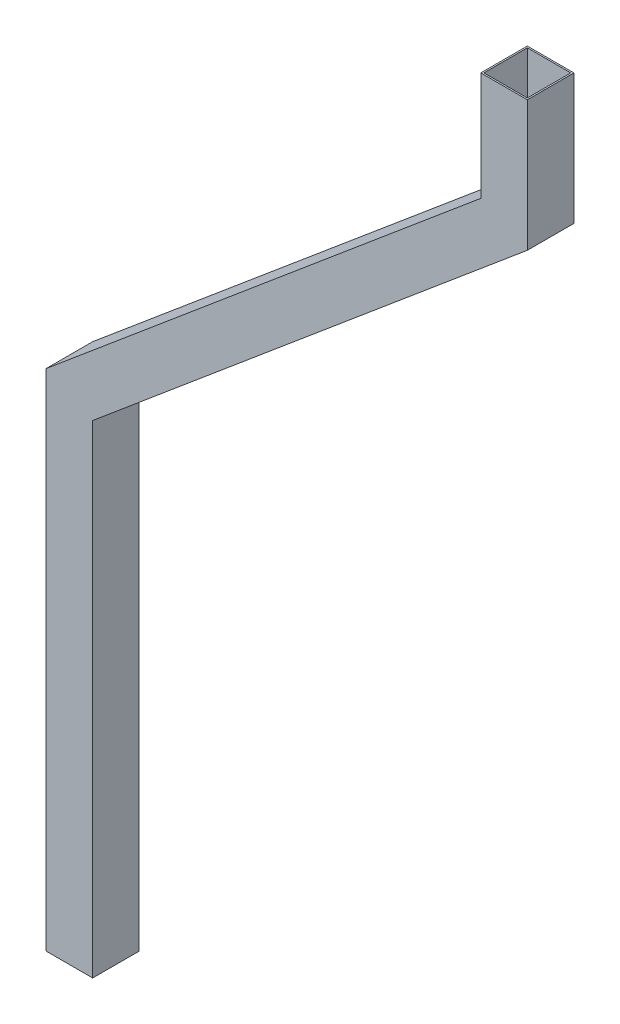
SolidWorks part; units mm, degrees
ref_plane "Piano frontale" through (0, 0, 0) normal (0, 0, 1) x (1, 0, 0)
ref_plane "Piano superiore" through (0, 0, 0) normal (0, 1, 0) x (1, 0, 0)
ref_plane "Piano destro" through (0, 0, 0) normal (1, 0, 0) x (0, 0, -1)
sketch "Schizzo1" plane through (0, 0, 0) normal (0, 0, 1) x (1, 0, 0)
  line L0 (0, 0) -> (0, 325)
  line L1 (0, 325) -> (280, 559.9479)
  line L2 (280, 559.9479) -> (280, 629.9479)
  dimension "D1" = 280
  dimension "D2" = 50
  dimension "D3" = 70
  dimension "D4" = 325
ref_plane "Piano1" through (0, 0, 0) normal (0, 1, 0) x (1, 0, 0)
sketch "Schizzo3" plane through (0, 0, 0) normal (0, 1, 0) x (1, 0, 0)
  line L1 (0, 0) -> (30, 0)
  line L2 (0, 0) -> (0, -30)
  line L3 (0, -30) -> (30, -30)
  line L4 (30, 0) -> (30, -30)
  dimension "D1" = 30
  dimension "D2" = 30
sweep "Sweep-Sottile1" add profiles "Schizzo3" path "Schizzo1" parameters "D1"=1
